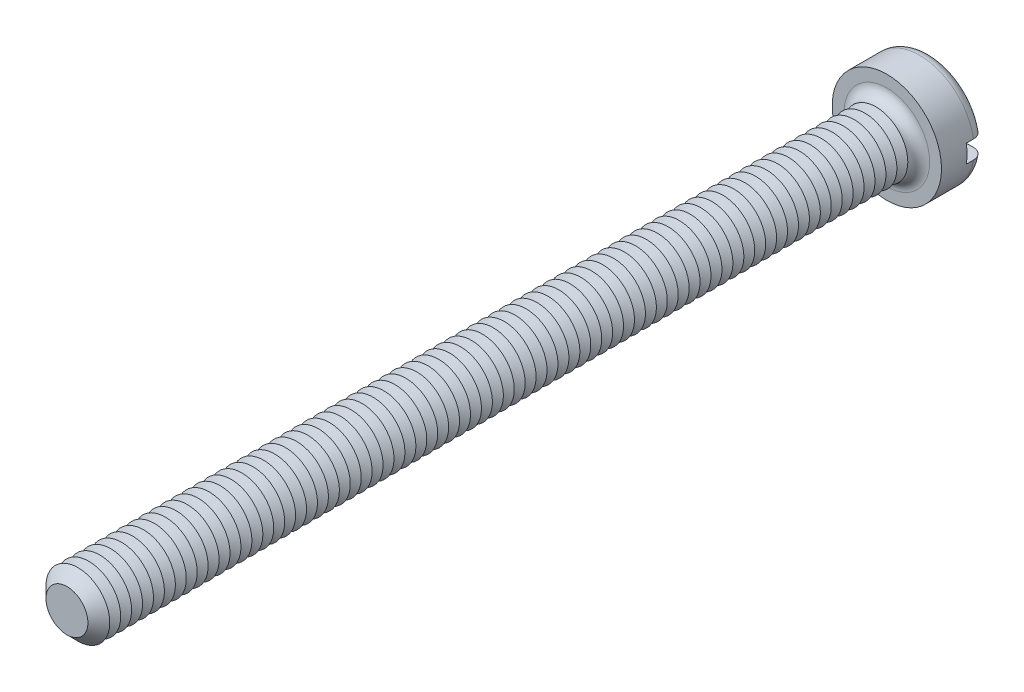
SolidWorks part; units mm, degrees
ref_plane "Front Plane" through (0, 0, 0) normal (0, 0, 1) x (1, 0, 0)
ref_plane "Top Plane" through (0, 0, 0) normal (0, 1, 0) x (1, 0, 0)
ref_plane "Right Plane" through (0, 0, 0) normal (1, 0, 0) x (0, 0, -1)
sketch "Sketch3" plane through (0, 0, 0) normal (0, 0, 1) x (1, 0, 0)
  circle A0 centre (0, 0) radius 3
  dimension "D1" = 6
extrude "Boss-Extrude2" add sketch "Sketch3" against normal blind 2.4
sketch "Sketch4" plane through (0, 0, 0) normal (0, 0, 1) x (1, 0, 0)
  circle A0 centre (0, 0) radius 1.75
  dimension "D1" = 3.5
extrude "Boss-Extrude3" add sketch "Sketch4" along normal blind 45
fillet "Fillet1" radius 0.6 2 edges at (3, 0, -2.4) (1.75, 0, 0)
chamfer "Chamfer1" distance 0.6 angle 45 1 edges at (1.75, 0, 45)
sketch "Sketch5" plane through (0, 0, 0) normal (1, 0, 0) x (0, 0, -1)
  line L0 (1.6944, 0) -> (-7.6738, 0) construction
sketch "Sketch6" plane through (0, 0, 0) normal (1, 0, 0) x (0, 0, -1)
  line L0 (-0.6, 1.75) -> (-0.9, 1.2304)
  line L1 (-0.9, 1.2304) -> (-1.2, 1.75)
  line L2 (-0.6, 1.75) -> (-44.4, 1.75) construction
  line L3 (-1.2, 1.75) -> (-0.6, 1.75)
  dimension "D1" = 0.6
revolve "Cut-Revolve1" cut sketch "Sketch6" angle 360 about L0
pattern_linear "LPattern1" count 73 spacing 0.6 along (0, 0, 1) of "Cut-Revolve1"
sketch "Sketch8" plane through (0, 0, -2.4) normal (0, 0, -1) x (-1, 0, 0)
  line L1 (3, -0.5) -> (-3, -0.5)
  line L2 (3, -0.5) -> (3, 0.5)
  line L3 (3, 0.5) -> (-3, 0.5)
  line L4 (-3, -0.5) -> (-3, 0.5)
  line L5 (3, -0.5) -> (-3, 0.5) construction
  line L6 (3, 0.5) -> (-3, -0.5) construction
  point P0 (0, 0)
  dimension "D1" = 6
  dimension "D2" = 1
extrude "Cut-Extrude1" cut sketch "Sketch8" against normal blind 1
